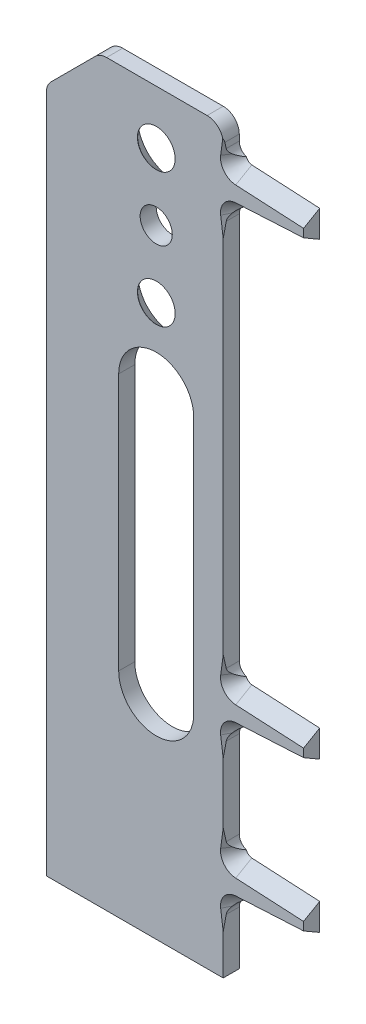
SolidWorks part; units mm, degrees
ref_plane "Plan de face" through (0, 0, 0) normal (0, 0, 1) x (1, 0, 0)
ref_plane "Plan de dessus" through (0, 0, 0) normal (0, 1, 0) x (1, 0, 0)
ref_plane "Plan de droite" through (0, 0, 0) normal (1, 0, 0) x (0, 0, -1)
sketch "Esquisse1" plane through (0, 0, 0) normal (0, 0, 1) x (1, 0, 0)
  line L0 (10.127, 50) -> (-8.6303, 50)
  line L1 (-10.7516, 49.1213) -> (-18.9943, 40.8787)
  line L2 (-19.873, 38.7574) -> (-19.873, -87.8704)
  line L3 (28.127, 42.5) -> (14.918, 43.8883)
  line L4 (13.127, 47) -> (13.127, 45.8774)
  line L5 (28.127, 42.5) -> (28.127, 37.5)
  line L6 (28.127, 37.5) -> (14.918, 36.1117)
  line L7 (-19.873, -87.8704) -> (13.127, -87.8704)
  line L8 (13.127, 34.1226) -> (13.127, -38.1226)
  line L9 (28.127, -41.5) -> (28.127, -46.5)
  line L10 (28.127, -41.5) -> (14.918, -40.1117)
  line L11 (28.127, -46.5) -> (14.918, -47.8883)
  line L12 (13.127, -49.8774) -> (13.127, -66.1226)
  line L13 (7.627, 0) -> (7.627, -48)
  line L14 (-6.373, 0) -> (-6.373, -48)
  line L15 (28.127, -69.5) -> (28.127, -74.5)
  line L16 (28.127, -69.5) -> (14.918, -68.1117)
  line L17 (28.127, -74.5) -> (14.918, -75.8883)
  line L18 (13.127, -77.8774) -> (13.127, -87.8704)
  arc A0 (13.127, 47) -> (10.127, 50) centre (10.127, 47) ccw
  arc A1 (13.127, 45.8774) -> (14.918, 43.8883) centre (15.127, 45.8774) ccw
  arc A2 (14.918, 36.1117) -> (13.127, 34.1226) centre (15.127, 34.1226) ccw
  arc A3 (-8.6303, 50) -> (-10.7516, 49.1213) centre (-8.6303, 47) ccw
  arc A4 (-18.9943, 40.8787) -> (-19.873, 38.7574) centre (-16.873, 38.7574) ccw
  arc A5 (13.127, -38.1226) -> (14.918, -40.1117) centre (15.127, -38.1226) ccw
  arc A6 (13.127, -66.1226) -> (14.918, -68.1117) centre (15.127, -66.1226) ccw
  arc A7 (14.918, -47.8883) -> (13.127, -49.8774) centre (15.127, -49.8774) ccw
  circle A8 centre (0.627, 40) radius 3.5
  circle A9 centre (0.627, 27.5) radius 3
  circle A10 centre (0.627, 15) radius 3.5
  arc A11 (-6.373, -48) -> (7.627, -48) centre (0.627, -48) ccw
  arc A12 (7.627, 0) -> (-6.373, 0) centre (0.627, 0) ccw
  arc A13 (14.918, -75.8883) -> (13.127, -77.8774) centre (15.127, -77.8774) ccw
extrude "Extrusion1" add sketch "Esquisse1" along normal blind 3
ref_plane "Plan1" through (0, -72.0004, 0) normal (0, -1, 0) x (1, 0, 0)
sketch "Esquisse4" plane through (28.127, 0, 0) normal (1, 0, 0) x (0, 0, -1)
  line L0 (-3, -68.8153) -> (1.179, -68.8021)
  line L4 (-3, -68.8153) -> (-3, -71.2321)
  line L6 (-3, -74.5) -> (-3, -69.5) construction
  line L8 (-3, -71.2321) -> (1.179, -68.8021)
sketch "Esquisse5" plane through (0, 0, 3) normal (0, 0, -1) x (-1, 0, 0)
  line L0 (-28.127, -71.2321) -> (-15.4669, -70.5582)
  line L4 (-13.127, -63.6245) -> (-12.653, -67.1642)
  line L6 (-28.127, -74.5) -> (-28.127, -69.5) construction
  line L8 (-13.127, -66.1226) -> (-13.127, -49.8774) construction
  arc A0 (-15.4669, -70.5582) -> (-12.653, -67.1642) centre (-15.6264, -67.5624) ccw
  dimension "D1" = 1.7321
  dimension "D2" = 6
sweep "Enlèvement de matière-Balayage8" cut profiles "Esquisse4" path "Esquisse5"
mirror "Symétrie6" about plane through (0, -72.0004, 0) normal (0, -1, 0) of "Enlèvement de matière-Balayage8"
pattern_linear "Répétition linéaire2" count 2 spacing 28 along (0, 1, 0) of "Enlèvement de matière-Balayage8", "Symétrie6"
pattern_linear "Répétition linéaire4" count 2 spacing 112 along (0, 1, 0) of "Enlèvement de matière-Balayage8", "Symétrie6"
ref_plane "Plan2" through (0.667, 0, 0) normal (-1, 0, 0) x (0, 0, 1)
sketch "Esquisse6" plane through (0.667, 0, 0) normal (-1, 0, 0) x (0, 0, 1)
  line L2 (0, 46.5) -> (3, 43.5)
  line L4 (0, 46.5) -> (0, 40)
  line L7 (0, 40) -> (3, 40)
  line L8 (3, 43.5) -> (3, 40)
revolve "Enlèvement de matière-Révolution1" cut sketch "Esquisse6" angle 360 about L7
pattern_linear "Répétition linéaire5" count 2 spacing 25 along (0, -1, 0) of "Enlèvement de matière-Révolution1"
